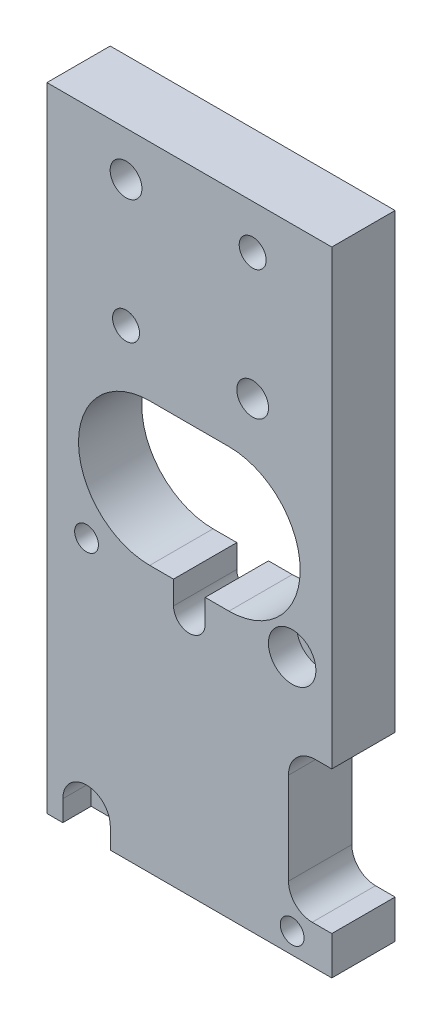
SolidWorks part; units mm, degrees
ref_plane "Front Plane" through (0, 0, 0) normal (0, 0, 1) x (1, 0, 0)
ref_plane "Top Plane" through (0, 0, 0) normal (0, 1, 0) x (1, 0, 0)
ref_plane "Right Plane" through (0, 0, 0) normal (1, 0, 0) x (0, 0, -1)
sketch "Sketch1" plane through (0, 0, 0) normal (0, 0, 1) x (1, 0, 0)
  line L1 (-14.2875, 31.75) -> (14.2875, 31.75)
  line L2 (-14.2875, 31.75) -> (-14.2875, -31.75)
  line L3 (-14.2875, -31.75) -> (14.2875, -31.75)
  line L4 (14.2875, 31.75) -> (14.2875, -31.75)
  dimension "D1" = 28.575
  dimension "D2" = 28.575
  dimension "D3" = 63.5
  dimension "D4" = 31.75
  dimension "D5" = 14.2875
  dimension "D6" = 31.75
extrude "Extrude1" add sketch "Sketch1" against normal blind 6.35
sketch "Sketch2" plane through (0, 0, 0) normal (0, 0, 1) x (1, 0, 0)
  line L0 (0, 29.7078) -> (0, -29.7809) construction
  line L1 (-14.2875, -31.75) -> (14.2875, -31.75) construction
  circle A0 centre (-6.35, 27.305) radius 1.5938
  circle A1 centre (6.35, 14.605) radius 1.5939
  circle A2 centre (0, -7.366) radius 1.5875
  circle A3 centre (-10.3124, -5.842) radius 1.1938
  circle A4 centre (10.3124, -29.6672) radius 1.1938
  circle A5 centre (10.3124, -5.842) radius 1.4351
  circle A6 centre (-10.3124, -29.6672) radius 1.4351
  dimension "D1" = 3.1877
  dimension "D2" = 3.1877
  dimension "D3" = 3.175
  dimension "D4" = 2.3876
  dimension "D5" = 2.3876
  dimension "D6" = 2.8702
  dimension "D7" = 2.8702
  dimension "D8" = 59.055
  dimension "D9" = 46.355
  dimension "D10" = 6.35
  dimension "D11" = 6.35
  dimension "D12" = 2.0828
  dimension "D13" = 24.384
  dimension "D14" = 2.0828
  dimension "D15" = 23.8252
  dimension "D16" = 23.8252
  dimension "D17" = 10.3124
  dimension "D18" = 10.3124
  dimension "D19" = 10.3124
  dimension "D20" = 10.3124
extrude "Cut-Extrude1" cut sketch "Sketch2" against normal through all
sketch "Sketch3" plane through (0, 0, 0) normal (0, 0, 1) x (1, 0, 0)
  line L0 (-14.2875, -31.75) -> (14.2875, -31.75) construction
  line L1 (-3.9751, 9.252) -> (3.9751, 9.252)
  line L2 (-1.5875, -7.366) -> (-1.5875, -5.0355)
  line L3 (3.9751, -5.0355) -> (1.5875, -5.0355)
  line L4 (1.5875, -7.366) -> (1.5875, -5.0355)
  line L5 (-1.5875, -5.0355) -> (-3.9751, -5.0355)
  line L6 (-1.5875, -7.366) -> (1.5875, -7.366)
  arc A0 (-3.9751, 9.252) -> (-3.9751, -5.0355) centre (-3.9751, 2.1082) ccw
  arc A1 (3.9751, -5.0355) -> (3.9751, 9.252) centre (3.9751, 2.1082) ccw
  dimension "D1" = 14.2875
  dimension "D2" = 14.2875
  dimension "D3" = 7.9502
  dimension "D4" = 3.9751
  dimension "D5" = 33.8582
  dimension "D6" = 33.8582
  dimension "D7" = 7.1437
  dimension "D8" = 7.1437
  dimension "D9" = 7.9502
extrude "Cut-Extrude4" cut sketch "Sketch3" against normal through all
sketch "Sketch4" plane through (0, 0, 0) normal (0, 0, 1) x (1, 0, 0)
  line L0 (-12.6937, -29.6672) -> (-12.6937, -31.75)
  line L1 (-12.6937, -31.75) -> (-7.9311, -31.75)
  line L2 (-7.9311, -31.75) -> (-7.9311, -29.6672)
  arc A0 (-7.9311, -29.6672) -> (-12.6937, -29.6672) centre (-10.3124, -29.6672) ccw
  circle A1 centre (10.3124, -5.842) radius 2.3813
  dimension "D1" = 4.7625
  dimension "D2" = 4.7625
extrude "Cut-Extrude5" cut sketch "Sketch4" against normal blind 2.8448
hole_wizard "#6-32 Tapped Hole1" positions "Sketch6" profile "Sketch5" tap size "#6-32" standard "Ansi Inch"
sketch "Sketch6" plane through (0, 0, 0) normal (0, 0, 1) x (1, 0, 0)
  line L0 (14.2875, -31.75) -> (14.2875, 31.75) construction
  line L1 (-14.2875, 31.75) -> (-14.2875, -31.75) construction
  line L2 (-7.9311, -31.75) -> (14.2875, -31.75) construction
  point P0 (-6.35, 14.605)
  point P1 (6.35, 27.305)
  dimension "D1" = 7.9375
  dimension "D2" = 7.9375
  dimension "D3" = 12.7
  dimension "D4" = 59.055
  dimension "D5" = 46.355
sketch "Sketch5" plane through (-6.35, 14.605, 0) normal (1, 0, 0) x (0, -1, 0)
  line L0 (0, 0) -> (0, 6.35)
  line L1 (0, 6.35) -> (1.3525, 6.35)
  line L2 (1.3525, 6.35) -> (1.3525, 0)
  line L5 (1.3525, 0) -> (0, 0)
  line L11 (0, -6.35) -> (0, 107.95) construction
  dimension "Thru Tap Drill Dia." = 2.7051
  dimension "Thru Tap Drill Depth" = 6.35
sketch "Sketch7" plane through (0, 0, 0) normal (0, 0, 1) x (1, 0, 0)
  line L0 (9.9441, 37.2878) -> (9.9441, -33.7021) construction
  line L1 (14.2875, -31.75) -> (14.2875, 31.75) construction
  line L2 (-13.3015, -27.8892) -> (12.3241, -27.8892)
  line L3 (12.661, -13.589) -> (14.2875, -13.589)
  line L4 (14.2875, -13.589) -> (14.2875, -27.8892)
  line L5 (9.9441, -16.3025) -> (9.9441, -25.5092)
  line L6 (-7.9311, -31.75) -> (14.2875, -31.75) construction
  line L7 (14.2875, -27.8892) -> (12.3241, -27.8892)
  arc A0 (12.661, -13.589) -> (9.9441, -16.3025) centre (12.6576, -16.3025) ccw
  arc A1 (9.9441, -25.5092) -> (12.3241, -27.8892) centre (12.3241, -25.5092) ccw
  dimension "D1" = 4.3434
  dimension "D2" = 14.3002
  dimension "D3" = 3.8608
  dimension "D4" = 9.2067
extrude "Cut-Extrude6" cut sketch "Sketch7" against normal through all contours L5 A1 L7 L3 A0 M11
